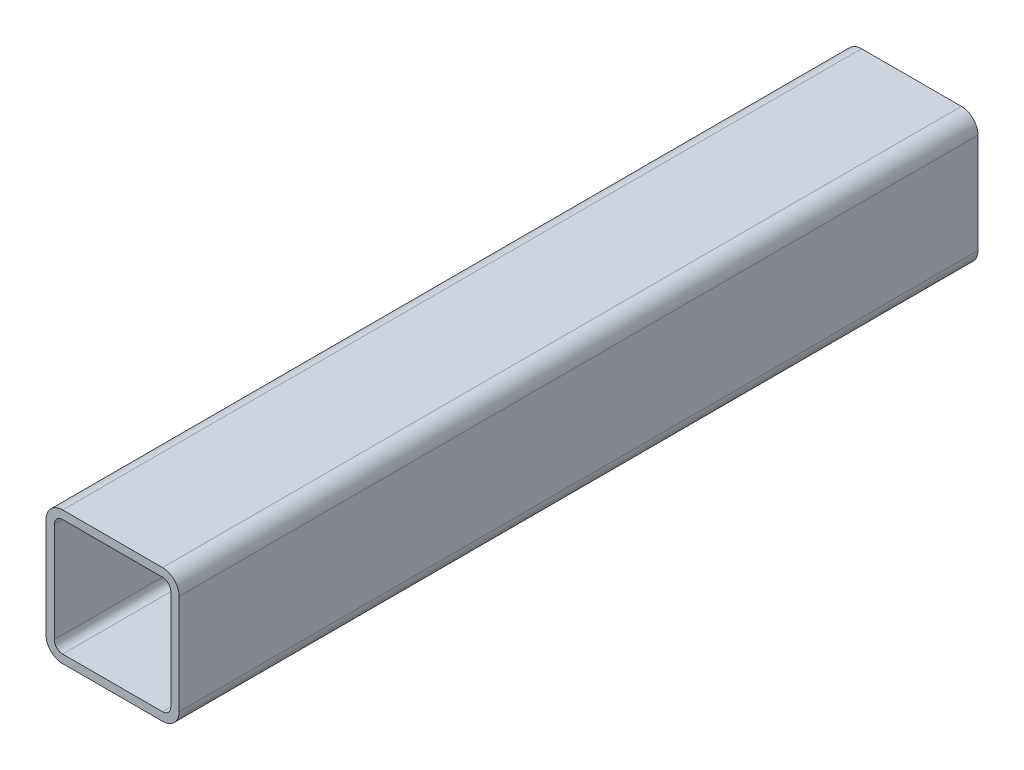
SolidWorks part; units mm, degrees
ref_plane "Front Plane" through (0, 0, 0) normal (0, 0, 1) x (1, 0, 0)
ref_plane "Top Plane" through (0, 0, 0) normal (0, 1, 0) x (1, 0, 0)
ref_plane "Right Plane" through (0, 0, 0) normal (1, 0, 0) x (0, 0, -1)
sketch "Sketch1" plane through (0, 0, 0) normal (0, 0, 1) x (1, 0, 0)
  line B0 (6.35, 47.625) -> (44.45, 47.625)
  arc B1 (47.625, 44.45) -> (44.45, 47.625) centre (44.45, 44.45) ccw
  line B2 (47.625, 44.45) -> (47.625, 6.35)
  arc B3 (44.45, 3.175) -> (47.625, 6.35) centre (44.45, 6.35) ccw
  line B4 (44.45, 3.175) -> (6.35, 3.175)
  arc B5 (3.175, 6.35) -> (6.35, 3.175) centre (6.35, 6.35) ccw
  line B6 (3.175, 6.35) -> (3.175, 44.45)
  arc B7 (6.35, 47.625) -> (3.175, 44.45) centre (6.35, 44.45) ccw
  line B8 (6.35, 50.8) -> (44.45, 50.8)
  arc B9 (50.8, 44.45) -> (44.45, 50.8) centre (44.45, 44.45) ccw
  line B10 (50.8, 44.45) -> (50.8, 6.35)
  arc B11 (44.45, 0) -> (50.8, 6.35) centre (44.45, 6.35) ccw
  line B12 (44.45, 0) -> (6.35, 0)
  arc B13 (0, 6.35) -> (6.35, 0) centre (6.35, 6.35) ccw
  line B14 (0, 6.35) -> (0, 44.45)
  arc B15 (6.35, 50.8) -> (0, 44.45) centre (6.35, 44.45) ccw
sketch_block_instance "HSS2x2x0.125-1"
sketch_block "HSS2x2x0.125"
extrude "Boss-Extrude1" add sketch "Sketch1" along normal blind 304.8
